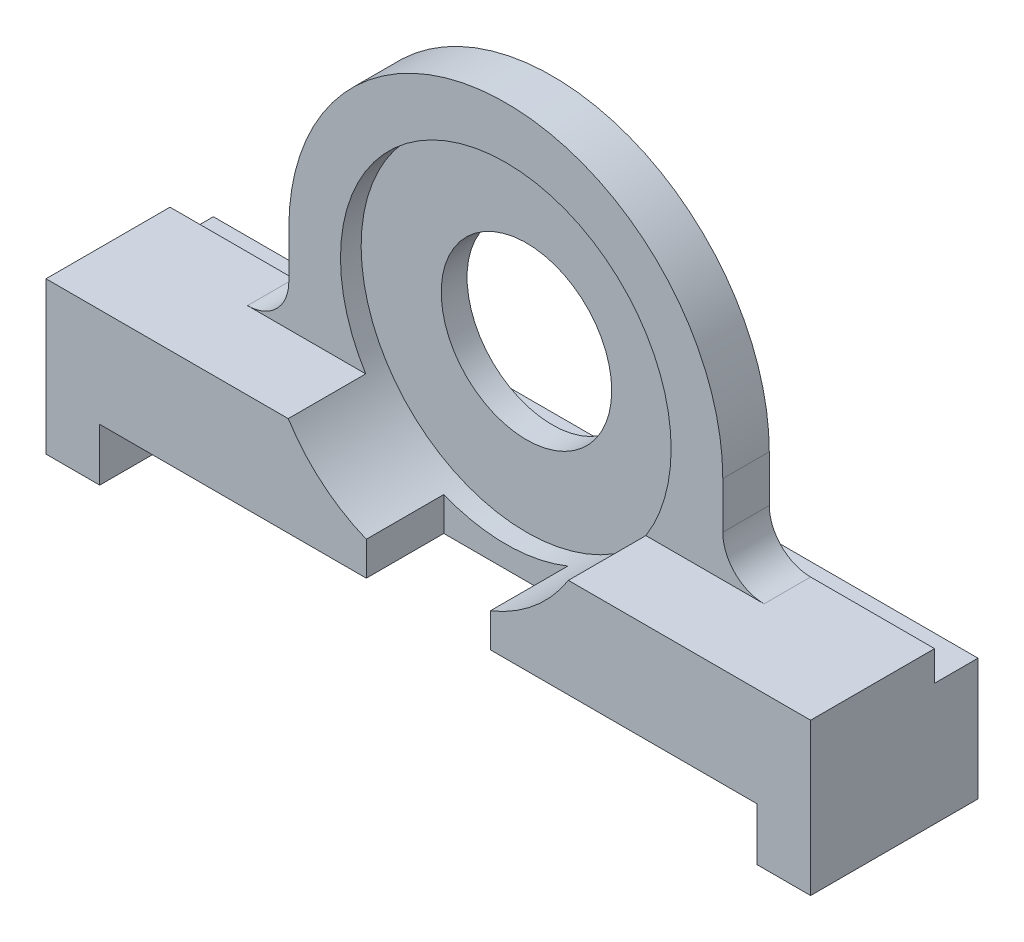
SolidWorks part; units mm, degrees
ref_plane "Front Plane" through (0, 0, 0) normal (0, 0, 1) x (1, 0, 0)
ref_plane "Top Plane" through (0, 0, 0) normal (0, 1, 0) x (1, 0, 0)
ref_plane "Right Plane" through (0, 0, 0) normal (1, 0, 0) x (0, 0, -1)
sketch "Sketch2" plane through (0, 0, 0) normal (0, 0, 1) x (1, 0, 0)
  line L0 (-21, 0) -> (21, 0)
  line L1 (-21, 14.7) -> (-21, 23.2)
  line L2 (21, 23.2) -> (21, 14.7)
  line L3 (21, 14.7) -> (37, 14.7)
  line L4 (37, 14.7) -> (37, 0)
  line L9 (37, 0) -> (21, 0)
  line L10 (0, 9.4378) -> (0, -16.7527) construction
  line L11 (-37, 0) -> (-21, 0)
  line L12 (-37, 14.7) -> (-37, 0)
  line L13 (-21, 14.7) -> (-37, 14.7)
  circle A1 centre (0, 23.2) radius 16
  arc A3 (-21, 23.2) -> (21, 23.2) centre (0, 23.2) cw
  point P2 (0, 44.2)
  point P7 (0, 0)
  point P8 (0, 0.9)
  point P10 (0, 7.2)
  point P12 (0, 39.2)
  dimension "D1" = 32
  dimension "D6" = 23.2
  dimension "D2" = 14.7
  dimension "D3" = 16
  dimension "D5" = 5
extrude "Boss-Extrude1" add sketch "Sketch2" along normal blind 12
sketch "Sketch3" plane through (0, 0, 0) normal (0, 0, 1) x (1, 0, 0)
  circle A1 centre (0, 23.2) radius 8.25
  circle A2 centre (0, 23.2) radius 16 construction
  circle A3 centre (0, 23.2) radius 16
  dimension "D1" = 16.5
extrude "Boss-Extrude2" add sketch "Sketch3" along normal blind 2.5
sketch "Sketch8" plane through (0, 0, 0) normal (0, 0, 1) x (1, 0, 0)
  line L1 (-27, 0) -> (27, 0)
  line L3 (-27, 10.6) -> (27, 10.6)
  line L4 (27, 7.2) -> (27, 10.6)
  line L5 (27, 7.2) -> (33.88, 7.2)
  line L6 (33.88, 7.2) -> (33.88, 0)
  line L7 (-37, 0) -> (37, 0) construction
  line L8 (0, 0) -> (0, 10.6) construction
  line L9 (26.68, 7) -> (33.68, 7) construction
  line L10 (33.68, 0) -> (33.68, 7) construction
  line L11 (24.68, 10.4) -> (-24.68, 10.4) construction
  line L12 (33.88, 0) -> (27, 0)
  line L13 (-33.88, 0) -> (-27, 0)
  line L14 (-33.88, 7.2) -> (-33.88, 0)
  line L15 (-27, 7.2) -> (-33.88, 7.2)
  line L16 (-27, 7.2) -> (-27, 10.6)
  point P6 (0, 10.6)
  dimension "D1" = 54
  dimension "D2" = 0.2
  dimension "D3" = 0.2
  dimension "D4" = 0.2
extrude "Cut-Extrude4" cut sketch "Sketch8" along normal blind 1
sketch "Sketch9" plane through (0, 0, 1) normal (0, 0, -1) x (-1, 0, 0)
  line L0 (-33.88, 0) -> (33.88, 0) construction
  line L1 (21.8, 0) -> (-21.8, 0)
  line L2 (21.8, 0) -> (21.8, 5.1)
  line L3 (21.8, 5.1) -> (-21.8, 5.1)
  line L4 (-21.8, 0) -> (-21.8, 5.1)
  line L5 (-27, 7.2) -> (-27, 10.6) construction
  point P6 (0, 5.1)
  dimension "D1" = 5.2
  dimension "D2" = 5.1
extrude "Cut-Extrude5" cut sketch "Sketch9" against normal up to next
sketch "Sketch10" plane through (0, 0, 0) normal (0, -1, 0) x (1, 0, 0)
  line L0 (-37, 12) -> (-21.8, 12) construction
  line L1 (-37, 12) -> (-37, 0) construction
  line L2 (0, 0) -> (0, 15.6223) construction
  line L3 (-37, 0) -> (-33.88, 0) construction
  circle A0 centre (-34, 9) radius 1.25
  circle A1 centre (-34, 3) radius 1.25
  circle A2 centre (34, 3) radius 1.25
  circle A3 centre (34, 9) radius 1.25
  dimension "D1" = 2.5
  dimension "D4" = 3
  dimension "D2" = 3
  dimension "D3" = 3
extrude "Cut-Extrude6" cut sketch "Sketch10" against normal blind 9
sketch "Sketch11" plane through (0, 0, 12) normal (0, 0, 1) x (1, 0, 0)
  line L0 (21, 14.7) -> (21, 23.2) construction
  line L1 (-21, 23.2) -> (-21, 14.7) construction
  line L2 (21, 14.7) -> (21, 23.2)
  line L3 (-21, 23.2) -> (-21, 14.7)
  line L4 (-21, 14.7) -> (21, 14.7)
  arc A0 (21, 23.2) -> (-21, 23.2) centre (0, 23.2) ccw construction
  arc A1 (21, 23.2) -> (-21, 23.2) centre (0, 23.2) ccw
extrude "Cut-Extrude7" cut sketch "Sketch11" against normal offset from surface (7.5 mm away) 2
fillet "Filete1" radius 2 2 edges at (27, 10.6, 0.5) (-27, 10.6, 0.5)
fillet "Filete2" radius 4 2 edges at (-21, 14.7, 2.25) (21, 14.7, 2.25)
sketch "Sketch12" plane through (0, 0, 12) normal (0, 0, 1) x (1, 0, 0)
  line L0 (21.8, 5.1) -> (-21.8, 5.1) construction
  line L1 (21.8, 0) -> (31.8, 0)
  line L2 (21.8, 0) -> (21.8, 5.1)
  line L3 (21.8, 5.1) -> (31.8, 5.1)
  line L4 (31.8, 0) -> (31.8, 5.1)
  line L5 (0, 0) -> (0, 5.354) construction
  line L6 (-31.8, 0) -> (-31.8, 5.1)
  line L7 (-21.8, 5.1) -> (-31.8, 5.1)
  line L8 (-21.8, 0) -> (-21.8, 5.1)
  line L9 (-21.8, 0) -> (-31.8, 0)
  dimension "D1" = 10
extrude "Cut-Extrude8" cut sketch "Sketch12" against normal blind 7
sketch "Sketch14" plane through (0, 0, 5) normal (0, 0, 1) x (1, 0, 0)
  line L1 (24.8, 1.05) -> (31.8, 1.05)
  line L2 (24.8, 1.05) -> (24.8, 4.05)
  line L3 (24.8, 4.05) -> (31.8, 4.05)
  line L4 (31.8, 1.05) -> (31.8, 4.05)
  line L5 (31.8, 0) -> (31.8, 5.1) construction
  line L6 (31.8, 0) -> (31.8, 5.1) construction
  line L7 (0, 0) -> (0, 5.8267) construction
  line L8 (-31.8, 1.05) -> (-31.8, 4.05)
  line L9 (-24.8, 4.05) -> (-31.8, 4.05)
  line L10 (-24.8, 1.05) -> (-24.8, 4.05)
  line L11 (-24.8, 1.05) -> (-31.8, 1.05)
  point P8 (31.8, 2.55)
  point P9 (-31.8, 2.55)
  dimension "D1" = 3
  dimension "D2" = 7
extrude "Cut-Extrude9" [suppressed] cut sketch "Sketch14" against normal blind 1.5
fillet "Fillet1" [suppressed] radius 1.5
sketch "Sketch15" plane through (0, 0, 12) normal (0, 0, 1) x (1, 0, 0)
  line L0 (31.8, 5.1) -> (-31.8, 5.1) construction
  line L1 (-6, 5.1) -> (6, 5.1)
  line L2 (-6, 5.1) -> (-6, 8.3676)
  line L3 (-6, 8.3676) -> (6, 8.3676)
  line L4 (6, 5.1) -> (6, 8.3676)
  arc A0 (-13.5554, 14.7) -> (13.5554, 14.7) centre (0, 23.2) ccw construction
  point P6 (0, 8.3676)
  dimension "D1" = 12
extrude "Cut-Extrude10" cut sketch "Sketch15" against normal up to surface (7.5 mm away)
sketch "Sketch16" plane through (0, 0, 0) normal (0, 0, -1) x (-1, 0, 0)
  line L0 (-37, 11.8) -> (37, 11.8)
  line L1 (-37, 0) -> (-37, 14.7) construction
  line L2 (37, 14.7) -> (37, 0) construction
  line L3 (-25, 10.6) -> (25, 10.6) construction
  line L5 (-33.88, 0) -> (-37, 0) construction
  line L6 (-33.88, 0) -> (-33.88, 7.2) construction
  line L7 (-33.88, 7.2) -> (-27, 7.2) construction
  line L8 (-27, 7.2) -> (-27, 8.6) construction
  line L9 (27, 8.6) -> (27, 7.2) construction
  line L10 (27, 7.2) -> (33.88, 7.2) construction
  line L11 (33.88, 7.2) -> (33.88, 0) construction
  line L12 (37, 0) -> (33.88, 0) construction
  line L13 (37, 0) -> (33.88, 0)
  line L14 (33.88, 7.2) -> (33.88, 0)
  line L15 (27, 7.2) -> (33.88, 7.2)
  line L16 (27, 8.6) -> (27, 7.2)
  line L17 (-25, 10.6) -> (25, 10.6)
  line L18 (-27, 7.2) -> (-27, 8.6)
  line L19 (-33.88, 7.2) -> (-27, 7.2)
  line L20 (-33.88, 0) -> (-33.88, 7.2)
  line L21 (-33.88, 0) -> (-37, 0)
  line L22 (-37, 11.8) -> (-37, 0)
  line L23 (37, 11.8) -> (37, 0)
  arc A0 (-25, 10.6) -> (-27, 8.6) centre (-25, 8.6) ccw construction
  arc A1 (27, 8.6) -> (25, 10.6) centre (25, 8.6) ccw construction
  arc A2 (27, 8.6) -> (25, 10.6) centre (25, 8.6) ccw
  arc A3 (-25, 10.6) -> (-27, 8.6) centre (-25, 8.6) ccw
  dimension "D1" = 1.2
extrude "Boss-Extrude3" add sketch "Sketch16" along normal blind 4.2
